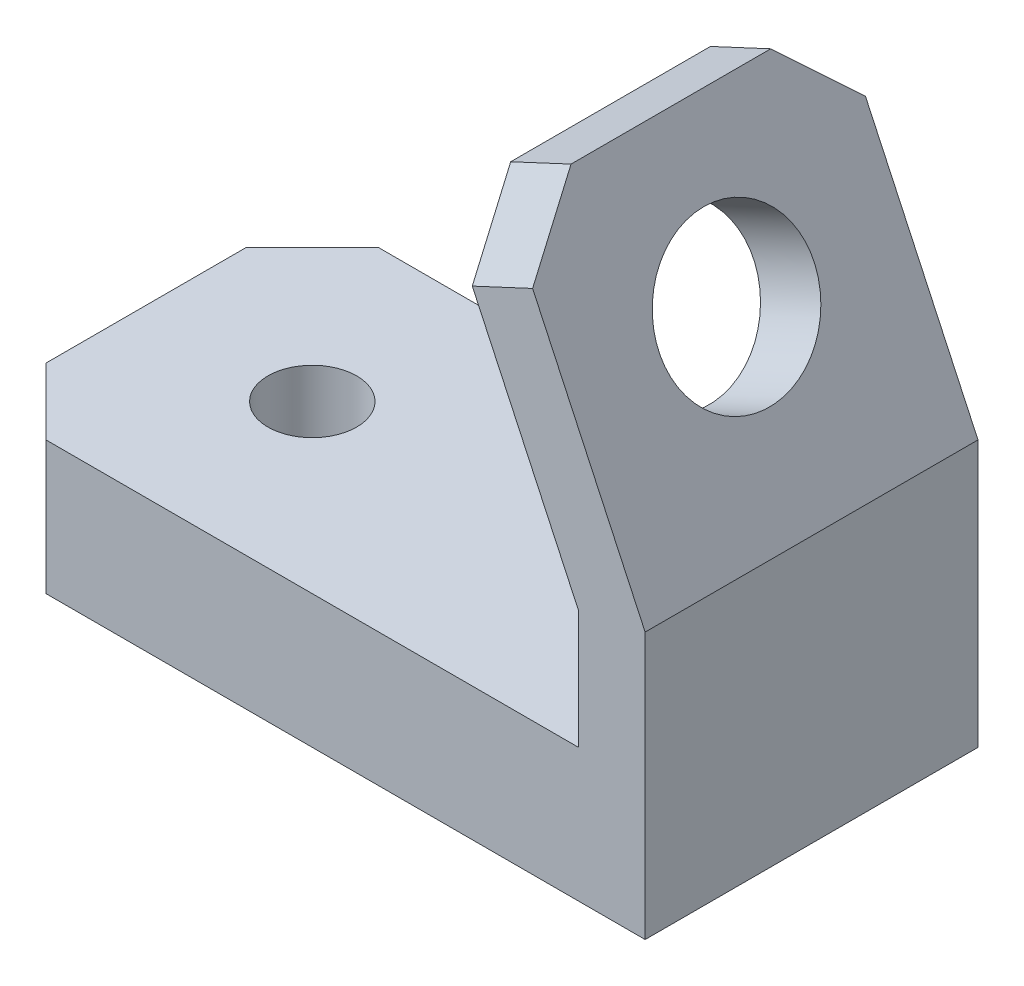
SolidWorks part; units mm, degrees
ref_plane "Ebene vorne" through (0, 0, 0) normal (0, 0, 1) x (1, 0, 0)
ref_plane "Ebene oben" through (0, 0, 0) normal (0, 1, 0) x (1, 0, 0)
ref_plane "Ebene rechts" through (0, 0, 0) normal (1, 0, 0) x (0, 0, -1)
sketch "Skizze1" plane through (0, 0, 0) normal (0, 0, 1) x (1, 0, 0)
  line L0 (0, 0) -> (30, 0)
  line L1 (30, 0) -> (30, 12)
  line L2 (30, 12) -> (23.6607, 25.5946)
  line L3 (23.6607, 25.5946) -> (20.9418, 24.3268)
  line L4 (20.9418, 24.3268) -> (27, 11.3349)
  line L5 (27, 11.3349) -> (27, 6)
  line L6 (27, 6) -> (0, 6)
  line L7 (0, 6) -> (0, 0)
  dimension "D1" = 6
  dimension "D2" = 30
  dimension "D3" = 12
  dimension "D4" = 25
  dimension "D5" = 3
  dimension "D6" = 3
  dimension "D7" = 15
extrude "Aufsatz-Linear austragen1" add sketch "Skizze1" along normal mid plane 15
hole_wizard "Ø4.0 (4) Durchmesser Bohrung1" positions "Skizze2" profile "Skizze3" hole size "Ø4.0" standard "DIN"
sketch "Skizze2" plane through (0, 0, 0) normal (0, -1, 0) x (-1, 0, 0)
  line L0 (-30, -7.5) -> (-30, 7.5) construction
  point P0 (-22.5, 0)
  point P2 (-7.5, 0)
  dimension "D1" = 7.5
  dimension "D2" = 15
sketch "Skizze3" plane through (22.5, 0, 0) normal (1, 0, 0) x (0, 0, -1)
  line L0 (0, 0) -> (0, 6)
  line L1 (0, 6) -> (2, 6)
  line L2 (2, 6) -> (2, 0)
  line L5 (2, 0) -> (0, 0)
  line L11 (0, -6.35) -> (0, 107.95) construction
  dimension "Bohrerdurchmesser" = 4
  dimension "Bohrungstiefe" = 6
hole_wizard "Ø7.0 (7) Durchmesser Bohrung1" positions "Skizze4" profile "Skizze5" hole size "Ø7.0" standard "DIN"
sketch "Skizze4" plane through (29.2381, 13.6339, 0) normal (0.9063, 0.4226, 0) x (0, 0, -1)
  line L1 (-7.5, 13.1971) -> (7.5, 13.1971) construction
  point P0 (0, 6.1971)
  dimension "D1" = 7
sketch "Skizze5" plane through (26.6191, 19.2505, 0) normal (0, 0, 1) x (-0.4226, 0.9063, 0)
  line L0 (0, 0) -> (0, 3)
  line L1 (0, 3) -> (3.5, 3)
  line L2 (3.5, 3) -> (3.5, 0)
  line L5 (3.5, 0) -> (0, 0)
  line L11 (0, -6.35) -> (0, 107.95) construction
  dimension "Bohrerdurchmesser" = 7
  dimension "Bohrungstiefe" = 3
chamfer "Fase1" distance 3 angle 45 4 edges at (22.3013, 24.9607, -7.5) (22.3013, 24.9607, 7.5) (0, 3, -7.5) (0, 3, 7.5)
sketch "Skizze6" plane through (26.5192, 12.3661, 0) normal (-0.9063, -0.4226, 0) x (0, 0, 1)
  circle A0 centre (0, 6.1971) radius 2.0888
